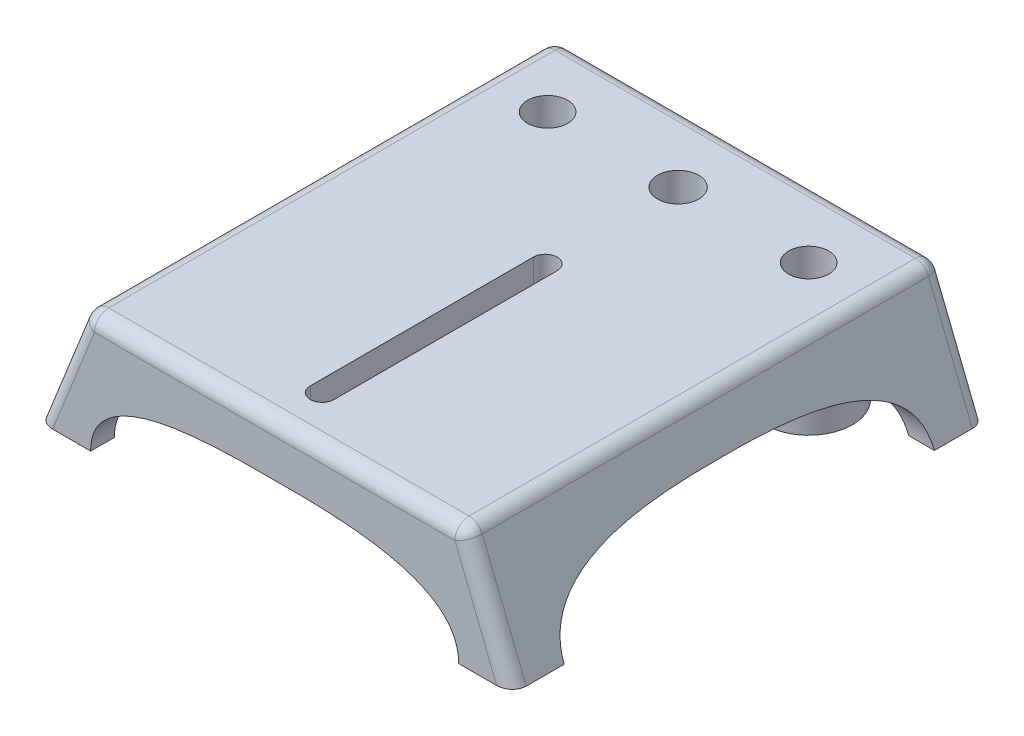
SolidWorks part; units mm, degrees
ref_plane "Front Plane" through (0, 0, 0) normal (0, 0, 1) x (1, 0, 0)
ref_plane "Top Plane" through (0, 0, 0) normal (0, 1, 0) x (1, 0, 0)
ref_plane "Right Plane" through (0, 0, 0) normal (1, 0, 0) x (0, 0, -1)
sketch "Sketch1" plane through (0, 0, 0) normal (0, 0, 1) x (1, 0, 0)
  line L0 (0, 44.2017) -> (0, -45.9877) construction
  line L1 (-64.6512, 0) -> (58.1463, 0) construction
  line L2 (-50, 0) -> (50, 0)
  line L3 (50, 0) -> (40, 25.0457)
  line L4 (40, 25.0457) -> (-40, 25.0457)
  line L5 (-40, 25.0457) -> (-50, 0)
  dimension "D1" = 100
  dimension "D2" = 80
extrude "Boss-Extrude1" add sketch "Sketch1" along normal blind 100
sketch "Sketch2" plane through (0, 25.0457, 0) normal (0, 1, 0) x (1, 0, 0)
  line L0 (0, 0) -> (0, -147.2429) construction
  line L1 (-26.1608, -15) -> (32.0859, -15) construction
  line L2 (40, 0) -> (-40, 0) construction
  circle A0 centre (-27.5, -15) radius 4.225
  circle A1 centre (27.5, -15) radius 4.225
  dimension "D1" = 8.45
  dimension "D2" = 27.5
  dimension "D3" = 15
extrude "Cut-Extrude1" cut sketch "Sketch2" against normal blind 20
sketch "Sketch4" plane through (0, 25.0457, 0) normal (0, 1, 0) x (1, 0, 0)
  line L0 (-27.5, -15) -> (27.5, -15) construction
  line L1 (0, 0) -> (0, -61.4812) construction
  circle A0 centre (0, -15) radius 4.35
  dimension "D1" = 8.7
extrude "Cut-Extrude2" cut sketch "Sketch4" against normal blind 8
ref_plane "Plane1" through (0, 17.0457, 0) normal (0, 1, 0) x (1, 0, 0)
sketch "Sketch5" plane through (0, 17.0457, 0) normal (0, 1, 0) x (1, 0, 0)
  line L0 (-20, -15) -> (-20, 0)
  line L1 (40, 0) -> (-40, 0) construction
  line L2 (-20, 0) -> (20, 0)
  line L3 (20, 0) -> (20, -15)
  arc A0 (-20, -15) -> (20, -15) centre (0, -15) ccw
  dimension "D1" = 40
extrude "Cut-Extrude3" cut sketch "Sketch5" against normal blind 10
shell "Shell1" thickness 5
sketch "Sketch6" plane through (0, 25.0457, 0) normal (0, 1, 0) x (1, 0, 0)
  line L0 (0, 0) -> (0, -94.9287) construction
  line L1 (40, 0) -> (-40, 0) construction
  line L2 (0, -90) -> (0, -43) construction
  line L3 (-2.5, -90) -> (-2.5, -43)
  line L4 (2.5, -90) -> (2.5, -43)
  arc A0 (-2.5, -90) -> (2.5, -90) centre (0, -90) ccw
  arc A1 (2.5, -43) -> (-2.5, -43) centre (0, -43) ccw
  point P6 (0, -66.5)
  dimension "D1" = 2.5
  dimension "D2" = 47
  dimension "D3" = 43
extrude "Cut-Extrude4" cut sketch "Sketch6" against normal up to next
fillet "Fillet1" radius 3 4 edges at (0, 20.0457, 40) (-36.6125, 20.0457, 55.718) (36.6125, 20.0457, 55.718) (0, 20.0457, 95)
fillet "Fillet2" radius 3 18 edges at (-29.79, 20.0457, 5) (-36.2627, 19.5294, 5) (29.79, 20.0457, 5) (36.2627, 19.5294, 5) (36.2627, 19.5294, 93.6827) (-36.2627, 19.5294, 93.6827) (-40.9912, 9.0791, 5) (40.9912, 9.0791, 5) (41.2133, 8.5229, 95) (-41.2133, 8.5229, 95) (0, 25.0457, 0) (0, 25.0457, 100) (40, 25.0457, 50) (-40, 25.0457, 50) (-45, 12.5229, 0) (45, 12.5229, 0) (45, 12.5229, 100) (-45, 12.5229, 100)
ref_plane "Plane2" through (50, 0, 0) normal (1, 0, 0) x (0, 0, -1)
sketch "Sketch8" plane through (50, 0, 0) normal (1, 0, 0) x (0, 0, -1)
  line L0 (-50, 23.1582) -> (-50, -18.1648) construction
  line L1 (-3, 23.1582) -> (-97, 23.1582) construction
  line L2 (-97, 0) -> (-3, 0) construction
  line L3 (-66.0038, 15.1582) -> (-33.9962, 15.1582) construction
  line L4 (-89, -11.8745) -> (-89, 11.8745) construction
  line L5 (-97, 23.1582) -> (-97, 0) construction
  line L6 (-89, 0) -> (-11, 0)
  spline S0 degree 3 poles (-50, 15.1582) (-63.3365, 15.1582) (-89, 14.8431) (-89, 0) knots 0 0 0 0 1 1 1 1
  spline S1 degree 3 poles (-50, 15.1582) (-36.6635, 15.1582) (-11, 14.8431) (-11, 0) knots 0 0 0 0 1 1 1 1
  dimension "D1" = 8
  dimension "D2" = 8
extrude "Cut-Extrude6" cut sketch "Sketch8" against normal up to next
mirror "Mirror1" about plane through (0, 0, 0) normal (1, 0, 0) of "Cut-Extrude6"
sketch "Sketch9" plane through (0, 0, 100) normal (0, 0, 1) x (1, 0, 0)
  line L0 (0, 0) -> (0, 39.2197) construction
  line L1 (-46.7697, 0) -> (46.7697, 0) construction
  line L2 (-15.1058, 14.0457) -> (15.1058, 14.0457) construction
  line L3 (-38.7697, -11.5076) -> (-38.7697, 11.5076) construction
  line L4 (37.9675, 22.0457) -> (-37.9675, 22.0457) construction
  line L5 (-38.7697, 0) -> (38.7697, 0)
  spline S0 degree 3 poles (0, 14.0457) (-12.5882, 14.0457) (-38.7697, 14.3844) (-38.7697, 0) knots 0 0 0 0 1 1 1 1
  spline S1 degree 3 poles (0, 14.0457) (12.5882, 14.0457) (38.7697, 14.3844) (38.7697, 0) knots 0 0 0 0 1 1 1 1
  dimension "D1" = 8
  dimension "D2" = 8
extrude "Cut-Extrude7" cut sketch "Sketch9" against normal up to next
